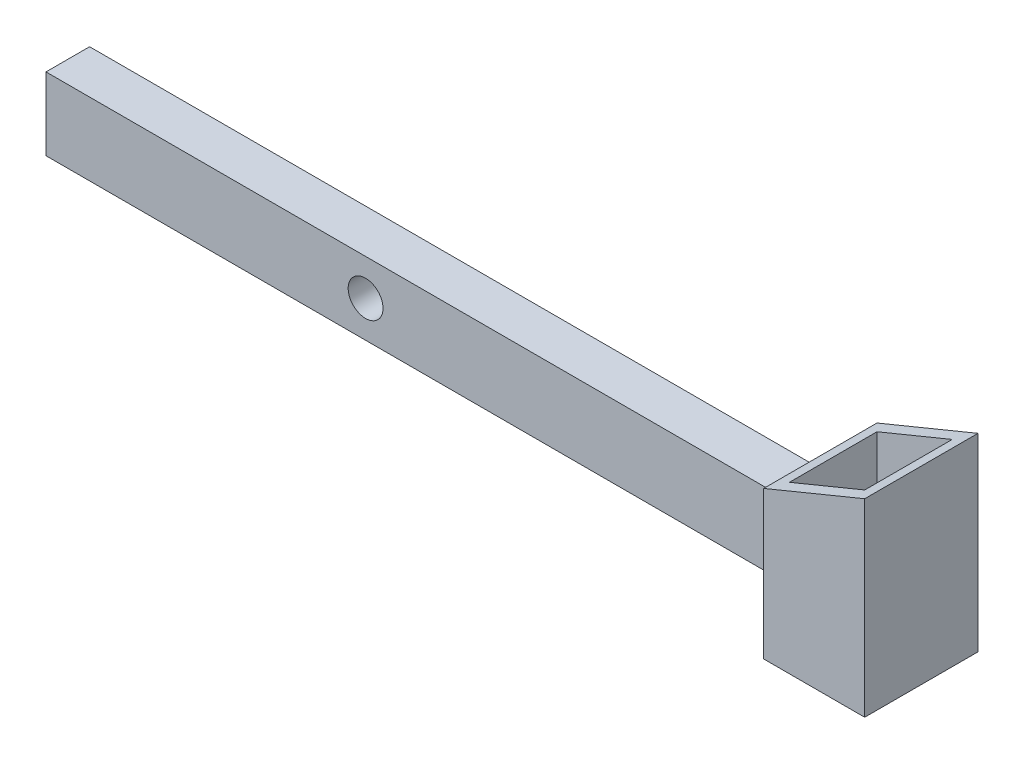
SolidWorks part; units mm, degrees
ref_plane "Front Plane" through (0, 0, 0) normal (0, 0, 1) x (1, 0, 0)
ref_plane "Top Plane" through (0, 0, 0) normal (0, 1, 0) x (1, 0, 0)
ref_plane "Right Plane" through (0, 0, 0) normal (1, 0, 0) x (0, 0, -1)
sketch "Sketch2" plane through (0, 0, 0) normal (0, 0, 1) x (1, 0, 0)
  line L0 (0, 50.8308) -> (34.7691, 65.1412)
  line L1 (0, 0) -> (34.7691, 0)
  line L2 (0, 0) -> (0, 50.8308)
  line L4 (34.7691, 0) -> (34.7691, 65.1412)
extrude "Boss-Extrude1" add sketch "Sketch2" along normal blind 38 and the other way blind 1
shell "Shell1" thickness 4.4293
sketch "Sketch4" plane through (0, -41.5147, 0) normal (-1, 0, 0) x (0, 0, 1)
  line L1 (10, 80) -> (25, 80)
  line L2 (10, 80) -> (10, 55)
  line L3 (10, 55) -> (25, 55)
  line L4 (25, 80) -> (25, 55)
extrude "Boss-Extrude2" add sketch "Sketch4" along normal blind 260
sketch "Sketch5" plane through (-260, -41.5147, 0) normal (-1, 0, 0) x (0, 0, 1)
  circle A0 centre (17.5, 67.5) radius 6
extrude "Cut-Extrude1" cut sketch "Sketch5" against normal blind 50
sketch "Sketch8" plane through (0, -41.5147, 25) normal (0, 0, 1) x (1, 0, 0)
  circle A0 centre (-150, 67.5) radius 6
extrude "Cut-Extrude4" cut sketch "Sketch8" against normal blind 20
sketch "Sketch9" plane through (0, -41.5147, 10) normal (0, 0, -1) x (-1, 0, 0)
  circle A0 centre (150, 67.5) radius 9
extrude "Cut-Extrude5" cut sketch "Sketch9" against normal blind 5
